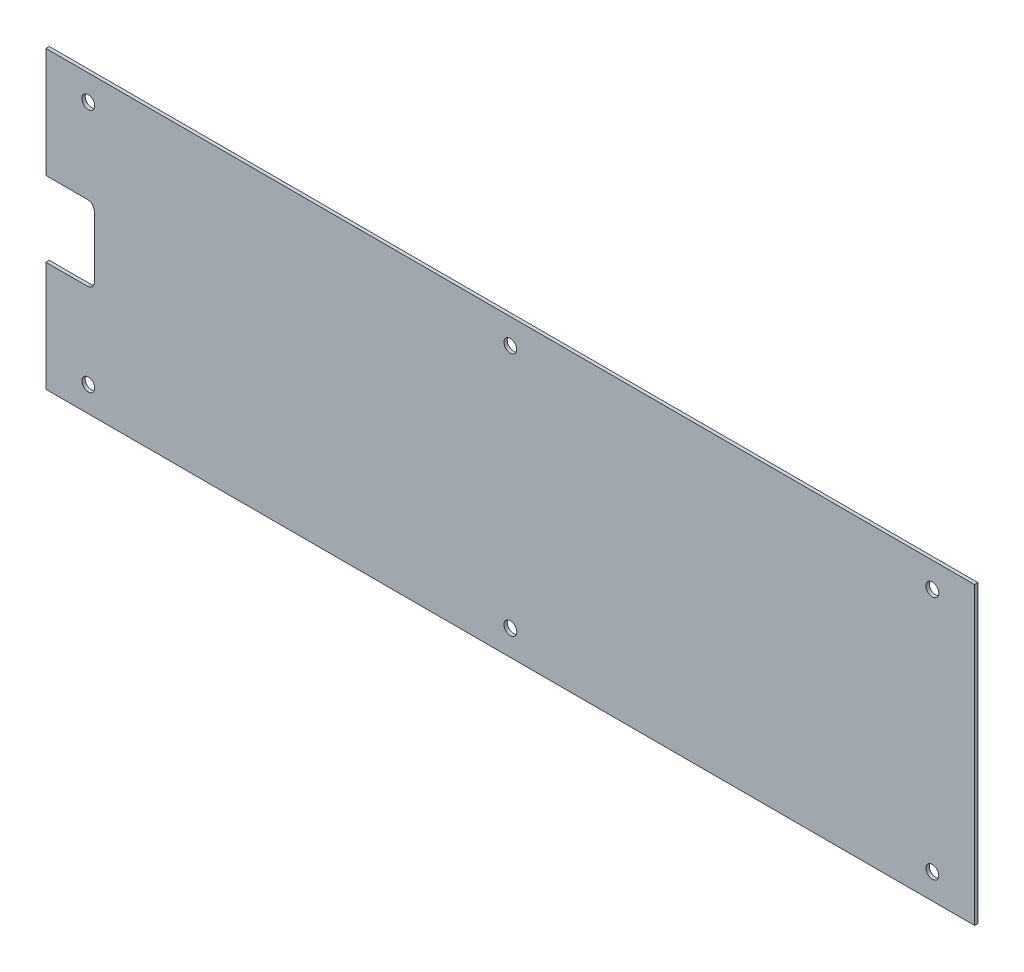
SolidWorks part; units mm, degrees
ref_plane "Front Plane" through (0, 0, 0) normal (0, 0, 1) x (1, 0, 0)
ref_plane "Top Plane" through (0, 0, 0) normal (0, 1, 0) x (1, 0, 0)
ref_plane "Right Plane" through (0, 0, 0) normal (1, 0, 0) x (0, 0, -1)
sketch "Sketch1" plane through (0, 0, 0) normal (0, 0, 1) x (1, 0, 0)
  line L1 (0, 0) -> (219.71, 0)
  line L2 (0, 0) -> (0, 69.85)
  line L3 (0, 69.85) -> (219.71, 69.85)
  line L4 (219.71, 0) -> (219.71, 69.85)
  dimension "D1" = 69.85
  dimension "D2" = 219.71
extrude "Extrude1" add sketch "Sketch1" along normal blind 0.7937
sketch "Sketch2" plane through (0, 0, 0.7937) normal (0, 0, 1) x (1, 0, 0)
  line L0 (109.855, 63.8556) -> (109.855, 5.9944) construction
  line L3 (219.71, 0) -> (219.71, 69.85) construction
  line L6 (219.71, 69.85) -> (0, 69.85) construction
  line L7 (219.71, 34.925) -> (0, 34.925) construction
  line L8 (0, 69.85) -> (0, 0) construction
  circle A0 centre (209.7024, 63.8556) radius 1.524
  circle A1 centre (109.855, 63.8556) radius 1.524
  circle A2 centre (109.855, 5.9944) radius 1.524
  circle A3 centre (209.7024, 5.9944) radius 1.524
  circle A4 centre (10.0076, 5.9944) radius 1.524
  circle A5 centre (10.0076, 63.8556) radius 1.524
  dimension "D1" = 3.048
  dimension "D2" = 10.0076
  dimension "D3" = 5.9944
  dimension "D4" = 5.9944
  dimension "D5" = 109.855
extrude "thru_holes" cut sketch "Sketch2" against normal through all
sketch "Sketch4" plane through (0, 0, 0.7937) normal (0, 0, 1) x (1, 0, 0)
  line L1 (0, 34.925) -> (17.381, 34.925) construction
  line L2 (0, 69.85) -> (0, 0) construction
  line L3 (0, 26.035) -> (0, 43.815)
  line L4 (0, 43.815) -> (9.8425, 43.815)
  line L5 (11.43, 42.2275) -> (11.43, 27.6225)
  line L7 (0, 26.035) -> (9.8425, 26.035)
  arc A0 (9.8425, 43.815) -> (11.43, 42.2275) centre (9.8425, 42.2275) cw
  arc A1 (9.8425, 26.035) -> (11.43, 27.6225) centre (9.8425, 27.6225) ccw
  point P8 (11.43, 34.925)
  point P11 (11.43, 43.815)
  point P14 (11.43, 26.035)
  dimension "D3" = 1.5875
  dimension "D1" = 8.89
  dimension "D2" = 11.43
extrude "notch" cut sketch "Sketch4" against normal blind 2.54
